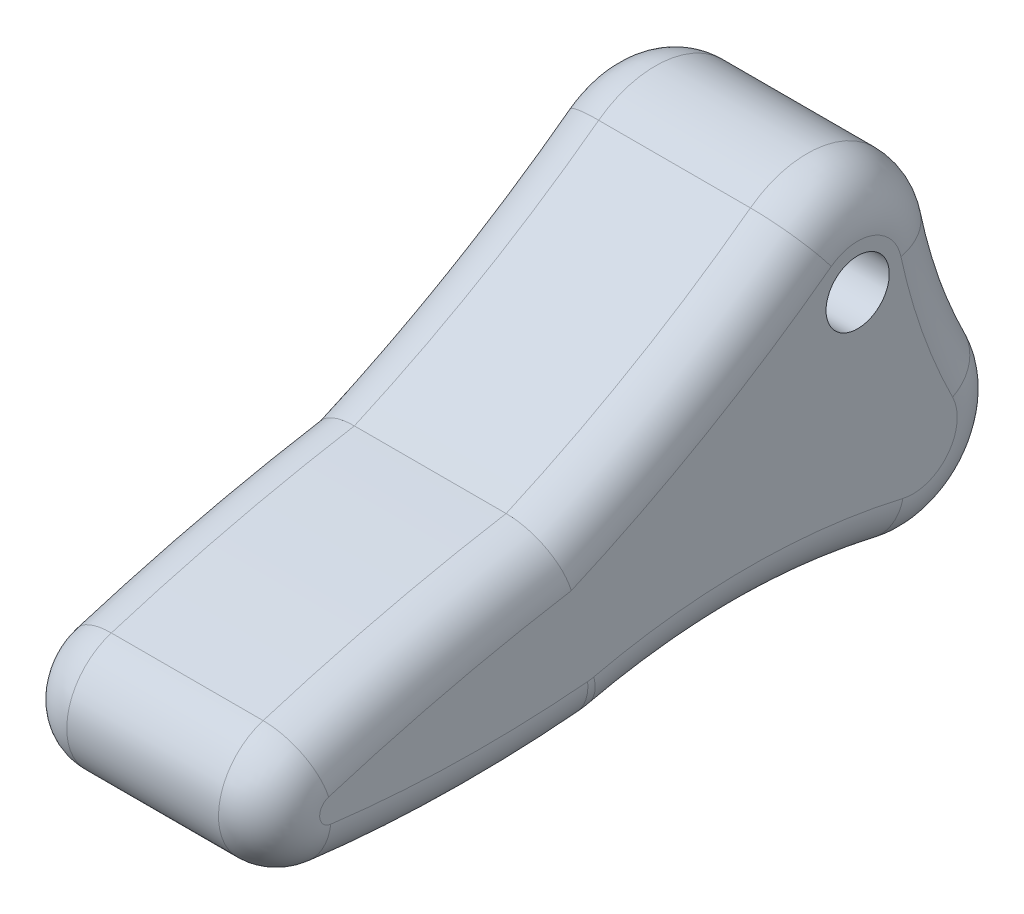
SolidWorks part; units mm, degrees
ref_plane "XY" through (0, 0, 0) normal (0, 0, 1) x (1, 0, 0)
ref_plane "YZ" through (0, 0, 0) normal (0, 1, 0) x (1, 0, 0)
ref_plane "XZ" through (0, 0, 0) normal (1, 0, 0) x (0, 0, -1)
sketch "Sketch11" plane through (0, 0, 0) normal (1, 0, 0) x (0, 0, -1)
  line L0 (22.2138, -63.5) -> (0, 0) construction
  line L1 (22.2138, -63.5) -> (-109.9852, -63.5) construction
  line L2 (-109.9852, -63.5) -> (0, 0) construction
  line L3 (0, 432.2232) -> (0, -432.2232) construction
  line L4 (-272.6544, -101.6) -> (281.7359, -101.6) construction
  arc A0 (37.2625, 7.9445) -> (-22.7575, 30.5566) centre (0, 0) ccw
  arc A1 (13.5921, -100.6117) -> (56.3029, -46.4841) centre (22.2138, -63.5) ccw
  arc A2 (-125.0693, -28.5131) -> (-101.3636, -100.6117) centre (-109.9852, -63.5) ccw
  arc A3 (56.3029, -46.4841) -> (37.2625, 7.9445) centre (260.8376, 55.6115) cw
  arc A4 (13.5921, -100.6117) -> (-101.3636, -100.6117) centre (-43.8857, -348.0229) ccw
  arc A5 (-125.0693, -28.5131) -> (-22.7575, 30.5566) centre (-326.1904, 437.9783) ccw
  dimension "D1" = 38.1
  dimension "D2" = 38.1
  dimension "D3" = 254
  dimension "D4" = 508
  dimension "D5" = 101.6
  dimension "D6" = 228.6
  dimension "D7" = 19.281
  dimension "D8" = 127
extrude "Base-Extrude" add sketch "Sketch11" along normal mid plane 101.6
sketch "Sketch12" plane through (0, 0, 0) normal (1, 0, 0) x (0, 0, -1)
  line L0 (-211.0219, -74.184) -> (-109.9852, -63.5) construction
  line L1 (0, 432.2232) -> (0, -432.2232) construction
  arc A0 (-106.6834, -101.4567) -> (-116.1042, -25.8946) centre (-109.9852, -63.5) ccw
  arc A1 (-218.5149, -49.9144) -> (-214.1964, -99.3849) centre (-211.0219, -74.184) ccw
  arc A2 (-218.5149, -49.9144) -> (-116.1042, -25.8946) centre (6.2761, -778.003) cw
  arc A3 (-214.1964, -99.3849) -> (-106.6834, -101.4567) centre (-150.7074, 404.6322) ccw
  dimension "D2" = 762
  dimension "D3" = 25.4
  dimension "D4" = 38.1
  dimension "D5" = 508
  dimension "D1" = 96.036
  dimension "D6" = 101.6
extrude "Boss-Extrude1" add sketch "Sketch12" along normal mid plane 101.6
fillet "Fillet1" radius 20.32
sketch "Sketch13" plane through (-50.8, 0, 0) normal (-1, 0, 0) x (0, 0, 1)
  circle A0 centre (0, 0) radius 12.7
  dimension "D1" = 25.4
extrude "Cut-Extrude1" cut sketch "Sketch13" against normal through all
